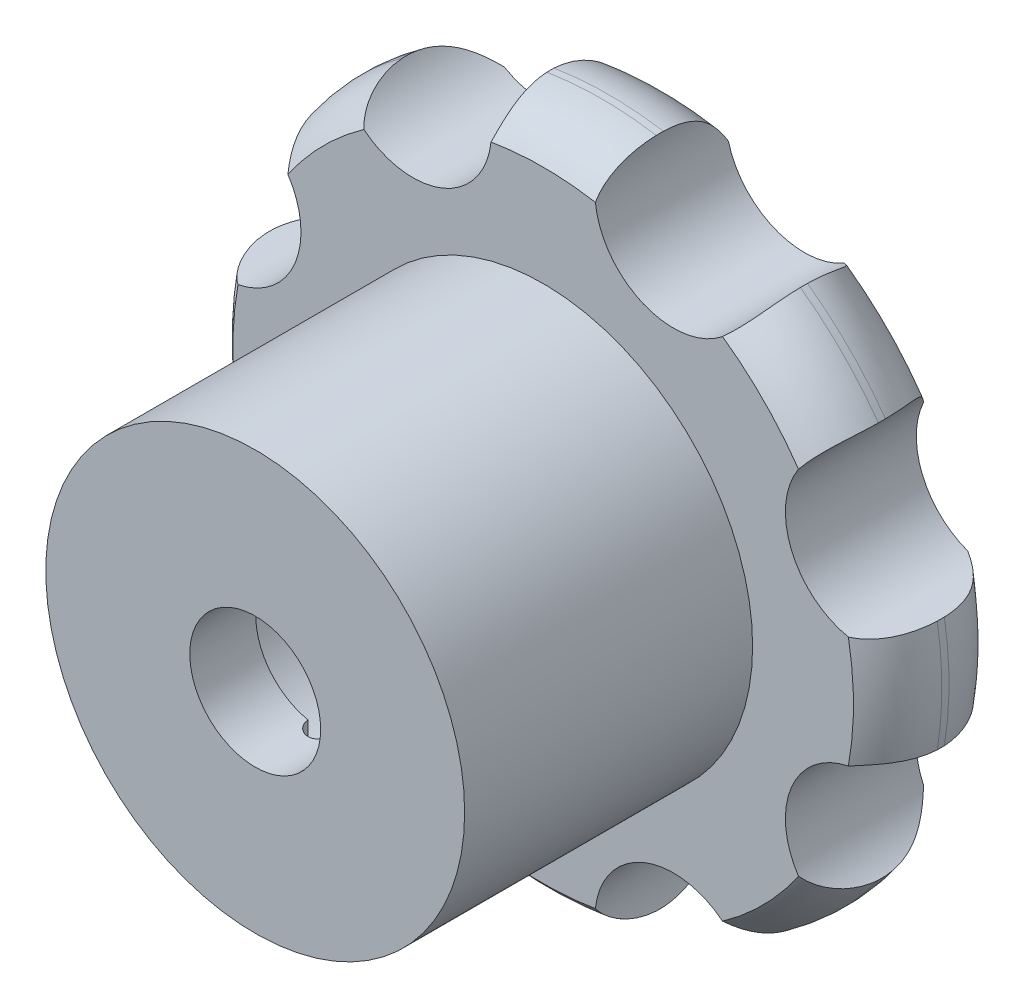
SolidWorks part; units mm, degrees
ref_plane "Plane1" through (0, 0, 0) normal (0, 0, 1) x (1, 0, 0)
ref_plane "Plane2" through (0, 0, 0) normal (0, 1, 0) x (1, 0, 0)
ref_plane "Plane3" through (0, 0, 0) normal (1, 0, 0) x (0, 0, -1)
sketch "Sketch1" plane through (0, 0, 0) normal (0, 0, 1) x (1, 0, 0)
  line L0 (0, 0) -> (0, 82.3862) construction
  line L1 (0, 0) -> (33.3106, 80.419) construction
  line L4 (0, 0) -> (74.9196, 0) construction
  circle A1 centre (0, 0) radius 12.7
  arc A2 (33.5734, 24.0094) -> (24.1159, 33.497) centre (0, 0) ccw
  arc A3 (6.6335, 40.7385) -> (24.1159, 33.497) centre (15.7953, 38.1331) ccw
  arc A4 (33.5734, 24.0094) -> (40.7172, 6.7628) centre (38.8996, 16.1128) ccw
  arc A5 (-6.6335, 40.7385) -> (-24.1159, 33.497) centre (-15.7953, 38.1331) cw
  arc A6 (-33.5734, 24.0094) -> (-40.7172, 6.7628) centre (-38.8996, 16.1128) cw
  arc A7 (-33.5734, -24.0094) -> (-40.7172, -6.7628) centre (-38.8996, -16.1128) ccw
  arc A8 (-6.6335, -40.7385) -> (-24.1159, -33.497) centre (-15.7953, -38.1331) ccw
  arc A9 (6.6335, -40.7385) -> (24.1159, -33.497) centre (15.7953, -38.1331) cw
  arc A10 (33.5734, -24.0094) -> (40.7172, -6.7628) centre (38.8996, -16.1128) cw
  arc A11 (40.7172, -6.7628) -> (40.7172, 6.7628) centre (0, 0) ccw
  arc A12 (24.1159, -33.497) -> (33.5734, -24.0094) centre (0, 0) ccw
  arc A13 (-6.6335, -40.7385) -> (6.6335, -40.7385) centre (0, 0) ccw
  arc A14 (-33.5734, -24.0094) -> (-24.1159, -33.497) centre (0, 0) ccw
  arc A15 (-40.7172, 6.7628) -> (-40.7172, -6.7628) centre (0, 0) ccw
  arc A16 (-24.1159, 33.497) -> (-33.5734, 24.0094) centre (0, 0) ccw
  arc A17 (6.6335, 40.7385) -> (-6.6335, 40.7385) centre (0, 0) ccw
  dimension "D2" = 25.4
  dimension "D3" = 82.55
  dimension "D6" = 19.05
  dimension "D7" = 19.05
  dimension "D4" = 22.5
extrude "Base-Extrude" add sketch "Sketch1" along normal blind 15.875
sketch "Sketch2" plane through (0, 0, 0) normal (1, 0, 0) x (0, 0, -1)
  line L0 (-7.9375, 40.7385) -> (-7.9375, -1.5592) construction
  line L1 (-15.875, 40.7385) -> (0, 40.7385) construction
  line L2 (0, 0) -> (18.0845, 0) construction
  line L3 (-15.875, 0) -> (0, 0) construction
  line L4 (-19.6582, 31.75) -> (-17.9023, 31.75)
  line L5 (0, 41.275) -> (-15.875, 41.275) construction
  line L6 (1.1671, 31.75) -> (2.9229, 31.75)
  line L7 (-19.6582, 31.75) -> (-19.6582, 43.7105)
  line L8 (-19.6582, 43.7105) -> (1.1671, 43.7105)
  line L9 (2.9229, 31.75) -> (2.9229, 43.7105)
  line L10 (2.9229, 43.7105) -> (1.1671, 43.7105)
  arc A0 (1.1671, 31.75) -> (-17.9023, 31.75) centre (-8.3676, 31.75) ccw
  dimension "D2" = 19.0694
  dimension "D1" = 9.525
revolve "Cut-Revolve1" cut sketch "Sketch2" angle 360 about L2
sketch "Sketch3" plane through (0, 0, 15.875) normal (0, 0, 1) x (1, 0, 0)
  circle A0 centre (0, 0) radius 25.4
  dimension "D1" = 50.8
extrude "Boss-Extrude1" add sketch "Sketch3" along normal blind 34.925
sketch "Sketch4" plane through (0, 0, 15.875) normal (0, 0, 1) x (1, 0, 0)
  circle A0 centre (0, 0) radius 12.7
  dimension "D1" = 25.4
extrude "Cut-Extrude1" cut sketch "Sketch4" along normal blind 26.924
sketch "Sketch5" plane through (0, 0, 50.8) normal (0, 0, 1) x (1, 0, 0)
  circle A0 centre (0, 0) radius 7.9375
  dimension "D1" = 15.875
extrude "Cut-Extrude2" cut sketch "Sketch5" against normal through all
sketch "Sketch6" plane through (0, 0, 0) normal (0, 1, 0) x (1, 0, 0)
  line L0 (0, 0) -> (0, -58.1869) construction
  line L1 (0, -8.7977) -> (0, -7.9375) construction
  circle A0 centre (0, -42.799) radius 1.5875
  dimension "D2" = 3.175
extrude "Cut-Extrude3" cut sketch "Sketch6" against normal through all
